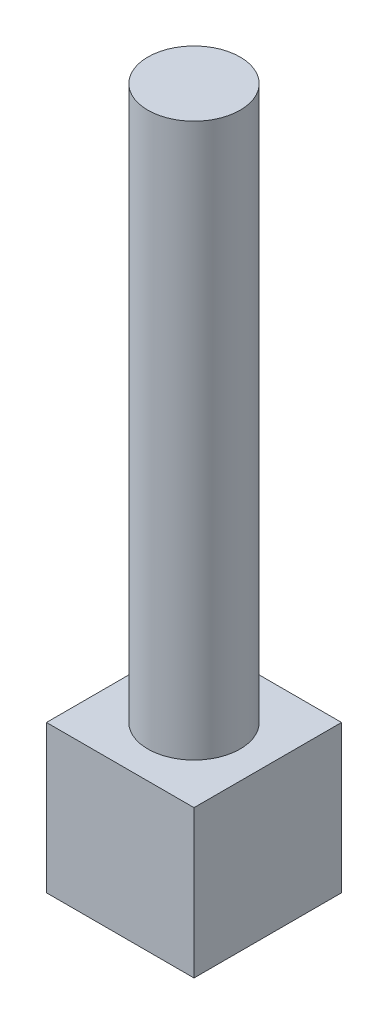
SolidWorks part; units mm, degrees
ref_plane "Face" through (0, 0, 0) normal (0, 0, 1) x (1, 0, 0)
ref_plane "Dessus" through (0, 0, 0) normal (0, 1, 0) x (1, 0, 0)
ref_plane "Droite" through (0, 0, 0) normal (1, 0, 0) x (0, 0, -1)
sketch "Esquisse1" plane through (0, 0, 0) normal (0, 0, 1) x (1, 0, 0)
  line L1 (0, 0) -> (40, 0)
  line L2 (0, 0) -> (0, 40)
  line L3 (0, 40) -> (40, 40)
  line L4 (40, 0) -> (40, 40)
  dimension "D1" = 40
  dimension "D2" = 40
extrude "Extrusion1" add sketch "Esquisse1" along normal blind 40
sketch "Esquisse2" plane through (0, 40, 0) normal (0, 1, 0) x (-1, 0, 0)
  line L0 (0, 40) -> (0, 0) construction
  line L1 (-40, 40) -> (0, 40) construction
  circle A0 centre (-20, 20) radius 12.5
  dimension "D1" = 25
  dimension "D3" = 20
  dimension "D2" = 20
extrude "Extrusion2" add sketch "Esquisse2" along normal blind 150
